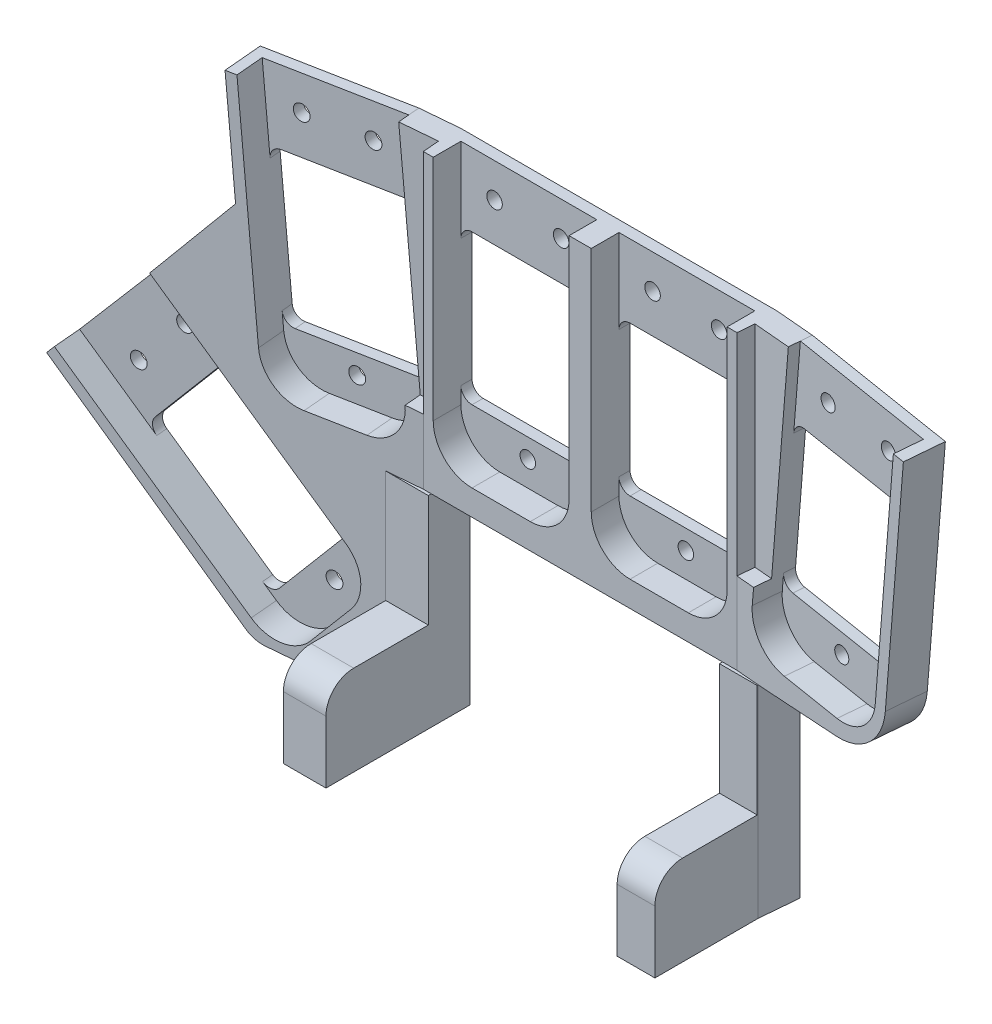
SolidWorks part; units mm, degrees
ref_plane "前视基准面" through (0, 0, 0) normal (0, 0, 1) x (1, 0, 0)
ref_plane "上视基准面" through (0, 0, 0) normal (0, 1, 0) x (1, 0, 0)
ref_plane "右视基准面" through (0, 0, 0) normal (1, 0, 0) x (0, 0, -1)
other "Configuration Table"
sketch "草图1" plane through (0, 0, 0) normal (0, 0, 1) x (1, 0, 0)
  line L0 (-6.3171, -14.436) -> (-6.3171, -11.436)
  line L1 (-8.3171, -13.436) -> (-28.8171, -13.436)
  line L2 (-30.8171, -11.436) -> (-30.8171, -14.436)
  line L3 (-23.8171, -21.436) -> (-13.3171, -21.436)
  line L4 (22.1829, -14.436) -> (22.1829, -11.436)
  line L5 (20.1829, -13.436) -> (-0.3171, -13.436)
  line L6 (-2.3171, -11.436) -> (-2.3171, -14.436)
  line L7 (4.6829, -21.436) -> (15.1829, -21.436)
  line L8 (22.1829, 11.564) -> (22.1829, 26.7199)
  line L9 (22.1829, 26.7199) -> (-2.3171, 26.7199)
  line L10 (-2.3171, 26.7199) -> (-2.3171, 11.564)
  line L11 (-0.3171, 13.564) -> (20.1829, 13.564)
  line L12 (-6.3171, 11.564) -> (-6.3171, 26.7199)
  line L13 (-6.3171, 26.7199) -> (-30.8171, 26.7199)
  line L14 (-30.8171, 26.7199) -> (-30.8171, 11.564)
  line L15 (-28.8171, 13.564) -> (-8.3171, 13.564)
  line L16 (-30.8171, 11.564) -> (-30.8171, -11.436)
  line L17 (-6.3171, 11.564) -> (-6.3171, -11.436)
  line L18 (22.1829, 11.564) -> (22.1829, -11.436)
  line L19 (-2.3171, 11.564) -> (-2.3171, -11.436)
  line L20 (-6.3171, 26.7199) -> (-2.3171, 26.7199)
  line L21 (-30.8171, 26.7199) -> (-32.8171, 26.7199)
  line L22 (-32.8171, 26.7199) -> (-32.8171, -25.4093)
  line L23 (-32.8171, -25.4093) -> (24.1829, -25.4093)
  line L24 (22.1829, 26.7199) -> (24.1829, 26.7199)
  line L25 (24.1829, 26.7199) -> (24.1829, -25.4093)
  arc A0 (-13.3171, -21.436) -> (-6.3171, -14.436) centre (-13.3171, -14.436) ccw
  arc A1 (-8.3171, -13.436) -> (-6.3171, -11.436) centre (-8.3171, -11.436) ccw
  arc A2 (-30.8171, -11.436) -> (-28.8171, -13.436) centre (-28.8171, -11.436) ccw
  arc A3 (-30.8171, -14.436) -> (-23.8171, -21.436) centre (-23.8171, -14.436) ccw
  arc A4 (15.1829, -21.436) -> (22.1829, -14.436) centre (15.1829, -14.436) ccw
  arc A5 (20.1829, -13.436) -> (22.1829, -11.436) centre (20.1829, -11.436) ccw
  arc A6 (-2.3171, -11.436) -> (-0.3171, -13.436) centre (-0.3171, -11.436) ccw
  arc A7 (-2.3171, -14.436) -> (4.6829, -21.436) centre (4.6829, -14.436) ccw
  arc A8 (-0.3171, 13.564) -> (-2.3171, 11.564) centre (-0.3171, 11.564) ccw
  arc A9 (22.1829, 11.564) -> (20.1829, 13.564) centre (20.1829, 11.564) ccw
  arc A10 (-28.8171, 13.564) -> (-30.8171, 11.564) centre (-28.8171, 11.564) ccw
  arc A11 (-6.3171, 11.564) -> (-8.3171, 13.564) centre (-8.3171, 11.564) ccw
sketch "草图2" plane through (0, 0, 0) normal (0, 0, 1) x (1, 0, 0)
  line L0 (-6.3171, -14.436) -> (-6.3171, -11.436)
  line L1 (-8.3171, -13.436) -> (-28.8171, -13.436)
  line L2 (-30.8171, -11.436) -> (-30.8171, -14.436)
  line L3 (-23.8171, -21.436) -> (-13.3171, -21.436)
  line L4 (22.1829, -14.436) -> (22.1829, -11.436)
  line L5 (20.1829, -13.436) -> (-0.3171, -13.436)
  line L6 (-2.3171, -11.436) -> (-2.3171, -14.436)
  line L7 (4.6829, -21.436) -> (15.1829, -21.436)
  line L8 (22.1829, 11.564) -> (22.1829, 26.7199)
  line L9 (22.1829, 26.7199) -> (-2.3171, 26.7199)
  line L10 (-2.3171, 26.7199) -> (-2.3171, 11.564)
  line L11 (-0.3171, 13.564) -> (20.1829, 13.564)
  line L12 (-6.3171, 11.564) -> (-6.3171, 26.7199)
  line L13 (-6.3171, 26.7199) -> (-30.8171, 26.7199)
  line L14 (-30.8171, 26.7199) -> (-30.8171, 11.564)
  line L15 (-28.8171, 13.564) -> (-8.3171, 13.564)
  line L16 (-30.8171, 11.564) -> (-30.8171, -11.436)
  line L17 (-6.3171, 11.564) -> (-6.3171, -11.436)
  line L18 (22.1829, 11.564) -> (22.1829, -11.436)
  line L19 (-2.3171, 11.564) -> (-2.3171, -11.436)
  line L20 (-6.3171, 26.7199) -> (-2.3171, 26.7199)
  line L21 (-30.8171, 26.7199) -> (-32.8171, 26.7199)
  line L22 (-32.8171, 26.7199) -> (-32.8171, -25.4093)
  line L23 (-32.8171, -25.4093) -> (24.1829, -25.4093)
  line L24 (22.1829, 26.7199) -> (24.1829, 26.7199)
  line L25 (24.1829, 26.7199) -> (24.1829, -25.4093)
  arc A0 (-13.3171, -21.436) -> (-6.3171, -14.436) centre (-13.3171, -14.436) ccw
  arc A1 (-8.3171, -13.436) -> (-6.3171, -11.436) centre (-8.3171, -11.436) ccw
  arc A2 (-30.8171, -11.436) -> (-28.8171, -13.436) centre (-28.8171, -11.436) ccw
  arc A3 (-30.8171, -14.436) -> (-23.8171, -21.436) centre (-23.8171, -14.436) ccw
  arc A4 (15.1829, -21.436) -> (22.1829, -14.436) centre (15.1829, -14.436) ccw
  arc A5 (20.1829, -13.436) -> (22.1829, -11.436) centre (20.1829, -11.436) ccw
  arc A6 (-2.3171, -11.436) -> (-0.3171, -13.436) centre (-0.3171, -11.436) ccw
  arc A7 (-2.3171, -14.436) -> (4.6829, -21.436) centre (4.6829, -14.436) ccw
  arc A8 (-0.3171, 13.564) -> (-2.3171, 11.564) centre (-0.3171, 11.564) ccw
  arc A9 (22.1829, 11.564) -> (20.1829, 13.564) centre (20.1829, 11.564) ccw
  arc A10 (-28.8171, 13.564) -> (-30.8171, 11.564) centre (-28.8171, 11.564) ccw
  arc A11 (-6.3171, 11.564) -> (-8.3171, 13.564) centre (-8.3171, 11.564) ccw
extrude "凸台-拉伸3" add sketch "草图1" along normal blind 2 contours A11 L12 L13 L14 A10 L15 | A9 L8 L9 L10 A8 L11 | L6 A7 L7 A4 L4 A5 L5 A6 | L2 A3 L3 A0 L0 A1 L1 A2 | A7 L6 L19 L10 L20 L12 L17 L0 A0 L3 A3 L2 L16 L14 L21 L22 L23 L25 L24 L8 L18 L4 A4 L7
sketch "草图4" plane through (0, 0, 2) normal (0, 0, 1) x (1, 0, 0)
  line L0 (4.6829, -21.436) -> (15.1829, -21.436) construction
  line L1 (22.1829, -14.436) -> (22.1829, -11.436) construction
  line L2 (22.1829, 11.564) -> (22.1829, -11.436) construction
  line L3 (22.1829, 26.7199) -> (24.1829, 26.7199) construction
  line L4 (24.1829, 26.7199) -> (24.1829, -25.4093) construction
  line L5 (22.1829, 11.564) -> (22.1829, 26.7199) construction
  line L6 (-2.3171, 26.7199) -> (-2.3171, 11.564) construction
  line L7 (-2.3171, 11.564) -> (-2.3171, -11.436) construction
  line L8 (-2.3171, -11.436) -> (-2.3171, -14.436) construction
  line L9 (-32.8171, -25.4093) -> (24.1829, -25.4093) construction
  line L10 (-32.8171, 26.7199) -> (-32.8171, -25.4093) construction
  line L11 (-30.8171, 26.7199) -> (-32.8171, 26.7199) construction
  line L12 (-6.3171, 11.564) -> (-6.3171, 26.7199) construction
  line L13 (-6.3171, 11.564) -> (-6.3171, -11.436) construction
  line L14 (-6.3171, -14.436) -> (-6.3171, -11.436) construction
  line L15 (-23.8171, -21.436) -> (-13.3171, -21.436) construction
  line L16 (-30.8171, -11.436) -> (-30.8171, -14.436) construction
  line L17 (-30.8171, 11.564) -> (-30.8171, -11.436) construction
  line L18 (-30.8171, 26.7199) -> (-30.8171, 11.564) construction
  line L19 (4.6829, -21.436) -> (15.1829, -21.436)
  line L20 (22.1829, -14.436) -> (22.1829, -11.436)
  line L21 (22.1829, 11.564) -> (22.1829, -11.436)
  line L22 (22.1829, 26.7199) -> (24.1829, 26.7199)
  line L23 (24.1829, 26.7199) -> (24.1829, -25.4093)
  line L24 (22.1829, 11.564) -> (22.1829, 26.7199)
  line L25 (-2.3171, 26.7199) -> (-2.3171, 11.564)
  line L26 (-2.3171, 11.564) -> (-2.3171, -11.436)
  line L27 (-2.3171, -11.436) -> (-2.3171, -14.436)
  line L28 (-32.8171, -25.4093) -> (24.1829, -25.4093)
  line L29 (-32.8171, 26.7199) -> (-32.8171, -25.4093)
  line L30 (-30.8171, 26.7199) -> (-32.8171, 26.7199)
  line L31 (-6.3171, 11.564) -> (-6.3171, 26.7199)
  line L32 (-6.3171, 11.564) -> (-6.3171, -11.436)
  line L33 (-6.3171, -14.436) -> (-6.3171, -11.436)
  line L34 (-23.8171, -21.436) -> (-13.3171, -21.436)
  line L35 (-30.8171, -11.436) -> (-30.8171, -14.436)
  line L36 (-30.8171, 11.564) -> (-30.8171, -11.436)
  line L37 (-30.8171, 26.7199) -> (-30.8171, 11.564)
  line L38 (-6.3171, 26.7199) -> (-2.3171, 26.7199)
  arc A0 (15.1829, -21.436) -> (22.1829, -14.436) centre (15.1829, -14.436) ccw construction
  arc A1 (-2.3171, -14.436) -> (4.6829, -21.436) centre (4.6829, -14.436) ccw construction
  arc A2 (-13.3171, -21.436) -> (-6.3171, -14.436) centre (-13.3171, -14.436) ccw construction
  arc A3 (-30.8171, -14.436) -> (-23.8171, -21.436) centre (-23.8171, -14.436) ccw construction
  arc A4 (15.1829, -21.436) -> (22.1829, -14.436) centre (15.1829, -14.436) ccw
  arc A5 (-2.3171, -14.436) -> (4.6829, -21.436) centre (4.6829, -14.436) ccw
  arc A6 (-13.3171, -21.436) -> (-6.3171, -14.436) centre (-13.3171, -14.436) ccw
  arc A7 (-30.8171, -14.436) -> (-23.8171, -21.436) centre (-23.8171, -14.436) ccw
extrude "凸台-拉伸4" add sketch "草图4" along normal blind 5
sketch "草图5" plane through (0, 0, 2) normal (0, 0, 1) x (1, 0, 0)
  circle A0 centre (9.747, -16.936) radius 1.4
  circle A5 centre (-18.753, -16.936) radius 1.4
  circle A10 centre (-24.753, 20.564) radius 1.4
  circle A11 centre (-12.753, 20.564) radius 1.4
  circle A13 centre (3.747, 20.564) radius 1.4
  circle A14 centre (15.747, 20.564) radius 1.4
extrude "切除-拉伸1" cut sketch "草图5" against normal blind 5
sketch "草图7" plane through (0, 26.7199, 0) normal (0, 1, 0) x (1, 0, 0)
  line L0 (-32.8171, 0) -> (-70.2267, -3.2729)
  line L1 (-32.8171, -7) -> (-32.8171, 0) construction
  line L2 (-32.8171, 0) -> (-32.8171, -2)
  line L3 (-32.8171, -2) -> (-70.053, -5.2577)
  line L4 (-70.2267, -3.2729) -> (-70.053, -5.2577)
  dimension "D1" = 85
extrude "凸台-拉伸5" add sketch "草图7" against normal up to surface (52.1292 mm away)
sketch "草图8" plane through (-0.0756, 0, -0.8645) normal (0.0872, 0, 0.9962) x (0.9962, 0, -0.0872)
  line L0 (-36.1156, -14.2794) -> (-36.3771, -11.2908)
  line L2 (-60.7838, -13.4261) -> (-60.5224, -16.4147)
  line L4 (-38.3817, 11.6217) -> (-39.7026, 26.7199)
  line L5 (-39.7026, 26.7199) -> (-64.1093, 24.5846)
  line L6 (-64.1093, 24.5846) -> (-62.7884, 9.4864)
  line L8 (-62.7884, 9.4864) -> (-60.7838, -13.4261)
  line L9 (-38.3817, 11.6217) -> (-36.3771, -11.2908)
  line L10 (-70.2447, 26.7199) -> (-32.8666, 26.7199) construction
  line L11 (-36.1156, -14.2794) -> (-36.3771, -11.2908)
  line L12 (-38.1951, -13.4575) -> (-58.6171, -15.2442)
  line L13 (-52.9389, -22.7779) -> (-42.4789, -21.8628)
  line L14 (-60.9703, 11.6531) -> (-40.5484, 13.4398)
  line L15 (-38.3817, 11.6217) -> (-39.7026, 26.7199)
  arc A1 (-38.1951, -13.4575) -> (-36.3771, -11.2908) centre (-38.3695, -11.4651) ccw
  arc A2 (-60.7838, -13.4261) -> (-58.6171, -15.2442) centre (-58.7915, -13.2518) ccw
  arc A3 (-60.5224, -16.4147) -> (-52.9389, -22.7779) centre (-53.549, -15.8046) ccw
  arc A4 (-60.9703, 11.6531) -> (-62.7884, 9.4864) centre (-60.796, 9.6607) ccw
  arc A5 (-38.3817, 11.6217) -> (-40.5484, 13.4398) centre (-40.374, 11.4474) ccw
  circle A6 centre (-48.2863, -17.8537) radius 1.4
  arc A7 (-38.1951, -13.4575) -> (-36.3771, -11.2908) centre (-38.3695, -11.4651) ccw
  arc A8 (-42.4789, -21.8628) -> (-36.1156, -14.2794) centre (-43.089, -14.8894) ccw
  circle A9 centre (-57.5318, 18.9807) radius 1.4
  circle A10 centre (-45.5775, 20.0265) radius 1.4
  arc A11 (-38.3817, 11.6217) -> (-40.5484, 13.4398) centre (-40.374, 11.4474) ccw
extrude "切除-拉伸2" cut sketch "草图8" against normal blind 54 contours A9 | A10 | A6 | L9 A5 L14 A4 L8 A2 L12 A1
sketch "草图9" plane through (-0.0756, 0, -0.8645) normal (0.0872, 0, 0.9962) x (0.9962, 0, -0.0872)
  line L0 (-38.3817, 11.6217) -> (-39.7026, 26.7199)
  line L1 (-70.2447, 26.7199) -> (-32.8666, 26.7199) construction
  line L2 (-39.7026, 26.7199) -> (-32.8666, 26.7199)
  line L3 (-32.8666, 26.7199) -> (-32.8666, -25.4093)
  line L4 (-32.8666, -25.4093) -> (-61.7354, -25.4093)
  line L5 (-60.7838, -13.4261) -> (-60.5224, -16.4147)
  line L6 (-60.7838, -13.4261) -> (-62.7884, 9.4864)
  line L7 (-62.7884, 9.4864) -> (-64.2962, 26.7199)
  line L8 (-64.2962, 26.7199) -> (-66.2962, 26.7199)
  line L9 (-66.2962, 26.7199) -> (-61.7354, -25.4093)
  line L10 (-60.7838, -13.4261) -> (-60.5224, -16.4147)
  line L11 (-36.1156, -14.2794) -> (-36.3771, -11.2908)
  line L13 (-52.9389, -22.7779) -> (-42.4789, -21.8628)
  line L14 (-38.3817, 11.6217) -> (-36.3771, -11.2908)
  circle A0 centre (-48.2863, -17.8537) radius 1.4
  arc A2 (-60.5224, -16.4147) -> (-52.9389, -22.7779) centre (-53.549, -15.8046) ccw
  arc A4 (-42.4789, -21.8628) -> (-36.1156, -14.2794) centre (-43.089, -14.8894) ccw
extrude "凸台-拉伸6" add sketch "草图9" along normal blind 5 contours A4 L13 A2 L5 L7 L9 L0 L11 M26 M19 M17 M18 M22
sketch "草图10" plane through (0, 26.7199, 0) normal (0, 1, 0) x (1, 0, 0)
  line L0 (24.1829, 0) -> (76.1307, -4.5448)
  line L1 (24.1829, -7) -> (24.1829, 0) construction
  line L3 (24.1829, -2) -> (76.1722, -6.5485)
  line L4 (76.1307, -4.5448) -> (76.1722, -6.5485)
  line L5 (24.1829, 0) -> (24.1829, -2)
  dimension "D1" = 85
extrude "凸台-拉伸7" add sketch "草图10" against normal up to surface (52.1292 mm away)
sketch "草图11" plane through (0.01, 0, -0.1148) normal (-0.0872, 0, 0.9962) x (0.9962, 0, 0.0872)
  line L0 (29.7802, 11.6217) -> (27.7757, -11.2908)
  line L1 (44.3375, -22.7779) -> (33.8775, -21.8628)
  line L2 (27.5142, -14.2794) -> (27.7757, -11.2908)
  line L3 (52.1824, -13.4261) -> (51.921, -16.4147)
  line L4 (57.6948, 26.7199) -> (53.134, -25.4093)
  line L5 (55.6948, 26.7199) -> (57.6948, 26.7199)
  line L6 (54.187, 9.4864) -> (55.6948, 26.7199)
  line L7 (52.1824, -13.4261) -> (54.187, 9.4864)
  line L8 (52.1824, -13.4261) -> (51.921, -16.4147)
  line L9 (24.2652, -25.4093) -> (53.134, -25.4093)
  line L10 (24.2652, 26.7199) -> (24.2652, -25.4093)
  line L11 (31.1012, 26.7199) -> (24.2652, 26.7199)
  line L12 (29.7802, 11.6217) -> (31.1012, 26.7199)
  arc A0 (33.8775, -21.8628) -> (27.5142, -14.2794) centre (34.4876, -14.8894) cw
  arc A1 (51.921, -16.4147) -> (44.3375, -22.7779) centre (44.9476, -15.8046) cw
  circle A2 centre (39.6849, -17.8537) radius 1.4
extrude "凸台-拉伸8" add sketch "草图11" along normal blind 5 contours L3 A1 L1 A0 L2 L0 L12 L4 L6 L7 M3 M4 M1
sketch "草图12" plane through (0.01, 0, -0.1148) normal (-0.0872, 0, 0.9962) x (0.9962, 0, 0.0872)
  line L6 (50.0157, -15.2442) -> (29.5937, -13.4575)
  line L8 (31.9469, 13.4398) -> (52.3689, 11.6531)
  line L9 (29.7802, 11.6217) -> (27.7757, -11.2908)
  line L10 (54.187, 9.4864) -> (52.1824, -13.4261)
  circle A5 centre (36.6057, 20.0589) radius 1.4
  circle A6 centre (48.56, 19.0131) radius 1.4
  circle A7 centre (39.3145, -17.8213) radius 1.4
  arc A8 (27.7757, -11.2908) -> (29.5937, -13.4575) centre (29.768, -11.4651) ccw
  arc A10 (50.0157, -15.2442) -> (52.1824, -13.4261) centre (50.19, -13.2518) ccw
  arc A12 (54.187, 9.4864) -> (52.3689, 11.6531) centre (52.1946, 9.6607) ccw
  arc A13 (31.9469, 13.4398) -> (29.7802, 11.6217) centre (31.7726, 11.4474) ccw
extrude "切除-拉伸3" cut sketch "草图12" against normal blind 5
sketch "草图14" plane through (0, -25.4093, 0) normal (0, -1, 0) x (1, 0, 0)
  line L12 (52.5061, 9.4971) -> (23.9646, 7)
  line L13 (23.9646, 7) -> (-32.5988, 7)
  line L14 (-32.5988, 7) -> (-61.1404, 9.4971)
  line L15 (-61.1404, 9.4971) -> (-61.5762, 4.5161)
  line L16 (-61.5762, 4.5161) -> (-70.053, 5.2577)
  line L17 (-70.053, 5.2577) -> (-70.2267, 3.2729)
  line L18 (-70.2267, 3.2729) -> (-32.8171, 0)
  line L19 (-32.8171, 0) -> (24.1829, 0)
  line L20 (24.1829, 0) -> (76.1307, 4.5448)
  line L21 (76.1307, 4.5448) -> (76.1722, 6.5485)
  line L22 (76.1722, 6.5485) -> (52.9419, 4.5161)
  line L23 (52.9419, 4.5161) -> (52.5061, 9.4971)
  line L24 (52.5061, 9.4971) -> (23.9646, 7)
  line L26 (-32.5988, 7) -> (-61.1404, 9.4971)
  line L27 (-61.1404, 9.4971) -> (-61.5762, 4.5161)
  line L28 (-61.5762, 4.5161) -> (-70.053, 5.2577)
  line L29 (-70.053, 5.2577) -> (-70.2267, 3.2729)
  line L30 (-70.2267, 3.2729) -> (-32.8171, 0)
  line L31 (-32.8171, 0) -> (24.1829, 0)
  line L32 (24.1829, 0) -> (76.1307, 4.5448)
  line L33 (76.1307, 4.5448) -> (76.1722, 6.5485)
  line L34 (76.1722, 6.5485) -> (52.9419, 4.5161)
  line L35 (52.9419, 4.5161) -> (52.5061, 9.4971)
  line L36 (23.9646, 7) -> (-32.5988, 7)
  dimension "D1" = 0
extrude "凸台-拉伸9" add sketch "草图14" along normal blind 48
sketch "草图16" plane through (-69.9774, 0, 6.1222) normal (-0.9962, 0, 0.0872) x (0.0872, 0, 0.9962)
  line L4 (-2.8602, 26.7199) -> (-2.8602, -73.4093)
  line L5 (-2.8602, -73.4093) -> (-0.8678, -73.4093)
  line L6 (-0.8678, -73.4093) -> (-0.8678, 26.7199)
  line L7 (-0.8678, 26.7199) -> (-2.8602, 26.7199)
  line L8 (-2.8602, 26.7199) -> (-2.8602, -73.4093)
  line L9 (-2.8602, -73.4093) -> (-0.8678, -73.4093)
  line L10 (-0.8678, -73.4093) -> (-0.8678, 26.7199)
  line L11 (-0.8678, 26.7199) -> (-2.8602, 26.7199)
  dimension "D1" = 0
extrude "凸台-拉伸10" add sketch "草图16" along normal blind 31
sketch "草图19" plane through (-0.0756, 0, -0.8645) normal (0.0872, 0, 0.9962) x (0.9962, 0, -0.0872)
  line L5 (-66.2962, 26.7199) -> (-101.2447, 26.7199)
  line L6 (-101.2447, 26.7199) -> (-101.2447, -73.4093)
  line L7 (-101.2447, -73.4093) -> (-61.7354, -73.4093)
  line L8 (-61.7354, -73.4093) -> (-61.7354, -25.4093)
  line L9 (-61.7354, -25.4093) -> (-66.2962, 26.7199)
  line L10 (-66.2962, 26.7199) -> (-101.2447, 26.7199)
  line L11 (-101.2447, 26.7199) -> (-101.2447, -73.4093)
  line L12 (-101.2447, -73.4093) -> (-61.7354, -73.4093)
  line L13 (-61.7354, -73.4093) -> (-61.7354, -25.4093)
  line L14 (-61.7354, -25.4093) -> (-66.2962, 26.7199)
  dimension "D1" = 0
extrude "凸台-拉伸12" add sketch "草图19" along normal blind 5 contours L10 L11 L12 L13 L14
sketch "草图20" plane through (0.3601, 0, 4.1165) normal (0.0872, 0, 0.9962) x (0.9962, 0, -0.0872)
  line L0 (-45.9906, -40.369) -> (-48.2888, -38.4406)
  line L1 (-48.0423, -41.2583) -> (-61.2194, -56.9622)
  line L2 (-64.0371, -57.2087) -> (-61.7389, -59.1371)
  line L3 (-51.8771, -58.2743) -> (-45.1278, -50.2308)
  line L4 (-78.6472, -12.9668) -> (-94.4978, -31.6491)
  line L5 (-94.4978, -31.6491) -> (-81.6561, -42.4246)
  line L6 (-81.9026, -39.6069) -> (-68.7255, -23.903)
  line L7 (-65.9078, -23.6565) -> (-78.6472, -12.9668)
  line L8 (-81.6561, -42.4246) -> (-64.0371, -57.2087)
  line L9 (-65.9078, -23.6565) -> (-48.2888, -38.4406)
  arc A0 (-45.1278, -50.2308) -> (-45.9906, -40.369) centre (-50.4902, -45.7313) ccw
  arc A1 (-48.0423, -41.2583) -> (-48.2888, -38.4406) centre (-49.5744, -39.9727) ccw
  arc A2 (-64.0371, -57.2087) -> (-61.2194, -56.9622) centre (-62.7515, -55.6766) ccw
  arc A3 (-61.7389, -59.1371) -> (-51.8771, -58.2743) centre (-57.2394, -53.7747) ccw
  arc A4 (-81.9026, -39.6069) -> (-81.6561, -42.4246) centre (-80.3705, -40.8925) ccw
  arc A5 (-65.9078, -23.6565) -> (-68.7255, -23.903) centre (-67.1934, -25.1886) ccw
  circle A6 centre (-76.9391, -22.8016) radius 1.4
  circle A7 centre (-84.6526, -31.9941) radius 1.4
  circle A8 centre (-52.0692, -51.5024) radius 1.4
extrude "切除-拉伸4" cut sketch "草图20" against normal blind 5 contours L9 A5 L6 A4 L8 A2 L1 A1 | A6 | A7 | A5 L7 L4 L5 A4 L6 A7 A6 | L2 A3 L3 A0 L0 A1 L1 A2 A8 | A8
sketch "草图22" plane through (-0.0756, 0, -0.8645) normal (0.0872, 0, 0.9962) x (0.9962, 0, -0.0872)
  circle A6 centre (-76.9391, -22.8016) radius 1.4
  circle A7 centre (-84.6526, -31.9941) radius 1.4
  circle A8 centre (-52.0692, -51.5024) radius 1.4
extrude "切除-拉伸5" cut sketch "草图22" against normal through all
sketch "草图23" plane through (-0.0756, 0, -0.8645) normal (0.0872, 0, 0.9962) x (0.9962, 0, -0.0872)
  line L1 (-48.0423, -41.2583) -> (-61.2194, -56.9622)
  line L6 (-81.9026, -39.6069) -> (-68.7255, -23.903)
  line L8 (-81.6561, -42.4246) -> (-64.0371, -57.2087)
  line L9 (-65.9078, -23.6565) -> (-48.2888, -38.4406)
  arc A1 (-48.0423, -41.2583) -> (-48.2888, -38.4406) centre (-49.5744, -39.9727) ccw
  arc A2 (-64.0371, -57.2087) -> (-61.2194, -56.9622) centre (-62.7515, -55.6766) ccw
  arc A4 (-81.9026, -39.6069) -> (-81.6561, -42.4246) centre (-80.3705, -40.8925) ccw
  arc A5 (-65.9078, -23.6565) -> (-68.7255, -23.903) centre (-67.1934, -25.1886) ccw
extrude "切除-拉伸6" cut sketch "草图23" against normal through all
sketch "草图24" plane through (0.3601, 0, 4.1165) normal (0.0872, 0, 0.9962) x (0.9962, 0, -0.0872)
  line L0 (-78.6472, -12.9668) -> (-94.4978, -31.6491)
  line L1 (-48.3684, -73.4093) -> (-101.2447, -73.4093)
  line L6 (-64.2962, 26.7199) -> (-101.2447, 26.7199) construction
  line L7 (-66.2962, 26.7199) -> (-64.3389, 4.3484)
  line L8 (-78.6472, -12.9668) -> (-64.3389, 4.3484)
  line L9 (-66.2962, 26.7199) -> (-101.2447, 26.7199)
  line L10 (-101.2447, 26.7199) -> (-101.2447, -73.4093)
  line L11 (-94.4978, -31.6491) -> (-95.7917, -33.1742)
  line L12 (-95.7917, -33.1742) -> (-48.3684, -73.4093)
  line L13 (-33.0849, -73.4093) -> (-101.2447, -73.4093) construction
extrude "切除-拉伸7" cut sketch "草图24" against normal through all
sketch "草图25" plane through (0, 0, 7) normal (0, 0, 1) x (1, 0, 0)
  line L8 (28.1628, -26.0179) -> (21.3541, -26.0179)
  line L9 (21.3541, -26.0179) -> (21.3541, -62.4789)
  line L10 (21.3541, -62.4789) -> (28.1628, -62.4789)
  line L11 (28.1628, -62.4789) -> (28.1628, -26.0179)
  line L12 (-38.8372, -62.4789) -> (-31.1575, -62.4789)
  line L13 (-31.1575, -62.4789) -> (-31.1575, -26.0179)
  line L14 (-31.1575, -26.0179) -> (-38.8372, -26.0179)
  line L15 (-38.8372, -26.0179) -> (-38.8372, -62.4789)
extrude "凸台-拉伸14" add sketch "草图25" along normal blind 19
sketch "草图26" plane through (0, 0, 7) normal (0, 0, 1) x (1, 0, 0)
  line L1 (-38.8372, -62.4789) -> (76.1722, -62.4789)
  line L2 (-38.8372, -62.4789) -> (-38.8372, -73.4093)
  line L3 (-38.8372, -73.4093) -> (76.1722, -73.4093)
  line L4 (76.1722, -62.4789) -> (76.1722, -73.4093)
  line L5 (-38.8372, -62.4789) -> (-63.6236, -62.4789)
  line L6 (-38.8372, -62.4789) -> (-38.8372, -73.4093)
  line L7 (-38.8372, -73.4093) -> (-63.6236, -73.4093)
  line L8 (-63.6236, -62.4789) -> (-63.6236, -73.4093)
extrude "切除-拉伸8" cut sketch "草图26" against normal through all and the other way through all contours L5 L8 L7 L2 | L1 M24 M25 M26 M27 M28 | L4 L1 L3 M27 | L2 L3 L1 M25
sketch "草图27" plane through (-0.4257, 0, 4.8661) normal (-0.0872, 0, 0.9962) x (0.9962, 0, 0.0872)
  line L1 (57.6948, 26.7199) -> (53.134, -25.4093) construction
  line L2 (57.6948, 26.7199) -> (53.134, -25.4093) construction
  line L3 (53.134, -25.4093) -> (28.6978, -26.0179)
  line L4 (28.6978, -26.0179) -> (28.6978, -62.4789)
  line L5 (28.6978, -62.4789) -> (53.134, -62.4789)
  line L7 (53.134, -62.4789) -> (53.134, -25.4093)
extrude "切除-拉伸9" cut sketch "草图27" against normal through all contours L3 L4 L5 L7
sketch "草图28" plane through (0.01, 0, -0.1148) normal (-0.0872, 0, 0.9962) x (0.9962, 0, 0.0872)
  line L5 (53.134, -62.4789) -> (76.4531, -62.4789)
  line L6 (76.4531, -62.4789) -> (76.4531, 26.7199)
  line L7 (76.4531, 26.7199) -> (57.6948, 26.7199)
  line L8 (57.6948, 26.7199) -> (53.134, -25.4093)
  line L11 (76.4531, -62.4789) -> (76.4531, 26.7199)
  line L12 (76.4531, 26.7199) -> (57.6948, 26.7199)
  line L13 (57.6948, 26.7199) -> (53.134, -25.4093)
  line L15 (53.134, -62.4789) -> (76.4531, -62.4789)
  line L17 (53.134, -25.4093) -> (53.134, -62.4789)
  line L18 (53.134, -25.4093) -> (53.134, -62.4789)
  dimension "D1" = 0
extrude "切除-拉伸10" cut sketch "草图28" against normal through all
sketch "草图29" plane through (-0.0756, 0, -0.8645) normal (0.0872, 0, 0.9962) x (0.9962, 0, -0.0872)
  line L0 (-39.7026, 26.7199) -> (-66.0942, 24.411)
  line L1 (-64.3389, 4.3484) -> (-66.2962, 26.7199) construction
  line L2 (-66.0942, 24.411) -> (-66.2962, 26.7199)
  line L3 (-66.2962, 26.7199) -> (-39.7026, 26.7199)
extrude "切除-拉伸11" cut sketch "草图29" against normal through all and the other way through all
sketch "草图31" plane through (0.01, 0, -0.1148) normal (-0.0872, 0, 0.9962) x (0.9962, 0, 0.0872)
  line L0 (31.1012, 26.7199) -> (57.4927, 24.411)
  line L1 (57.6948, 26.7199) -> (53.134, -25.4093) construction
  line L2 (57.4927, 24.411) -> (57.6948, 26.7199)
  line L3 (57.6948, 26.7199) -> (31.1012, 26.7199)
extrude "切除-拉伸13" cut sketch "草图31" against normal through all and the other way through all
sketch "草图32" plane through (0.3601, 0, 4.1165) normal (0.0872, 0, 0.9962) x (0.9962, 0, -0.0872)
  line L14 (-61.2515, -62.4789) -> (-39.347, -62.4789)
  line L15 (-39.347, -62.4789) -> (-39.347, -26.0179)
  line L16 (-64.1093, 24.5846) -> (-66.0942, 24.411)
  line L17 (-66.0942, 24.411) -> (-64.3389, 4.3484)
  line L18 (-64.3389, 4.3484) -> (-78.6472, -12.9668)
  line L19 (-78.6472, -12.9668) -> (-45.9906, -40.369)
  line L20 (-45.1278, -50.2308) -> (-51.8771, -58.2743)
  line L21 (-61.7389, -59.1371) -> (-94.4978, -31.6491)
  line L22 (-94.4978, -31.6491) -> (-95.7917, -33.1742)
  line L23 (-95.7917, -33.1742) -> (-61.2515, -62.4789)
  line L26 (-39.347, -62.4789) -> (-39.347, -26.0179)
  line L28 (-33.0849, 26.7199) -> (-39.7026, 26.7199)
  line L29 (-39.7026, 26.7199) -> (-36.1156, -14.2794)
  line L30 (-42.4789, -21.8628) -> (-52.9389, -22.7779)
  line L31 (-60.5224, -16.4147) -> (-64.1093, 24.5846)
  line L45 (-39.347, -26.0179) -> (-33.0849, -26.0179)
  line L46 (-33.0849, -26.0179) -> (-33.0849, 26.7199)
  arc A4 (-45.1278, -50.2308) -> (-45.9906, -40.369) centre (-50.4902, -45.7313) ccw
  arc A5 (-61.7389, -59.1371) -> (-51.8771, -58.2743) centre (-57.2394, -53.7747) ccw
  arc A6 (-42.4789, -21.8628) -> (-36.1156, -14.2794) centre (-43.089, -14.8894) ccw
  arc A7 (-60.5224, -16.4147) -> (-52.9389, -22.7779) centre (-53.549, -15.8046) ccw
  dimension "D1" = 0
sketch "草图33" plane through (0.3601, 0, 4.1165) normal (0.0872, 0, 0.9962) x (0.9962, 0, -0.0872)
  line L0 (-39.7026, 26.7199) -> (-33.0849, 26.7199)
  line L1 (-36.1156, -14.2794) -> (-33.0849, -14.2794)
  line L2 (-33.0849, 26.7199) -> (-33.0849, -14.2794)
  line L3 (-33.0849, -26.0179) -> (-33.0849, 26.7199) construction
  line L4 (-36.1156, -14.2794) -> (-39.7026, 26.7199)
extrude "切除-拉伸15" cut sketch "草图33" against normal blind 3
sketch "草图34" plane through (-0.4257, 0, 4.8661) normal (-0.0872, 0, 0.9962) x (0.9962, 0, 0.0872)
  line L0 (31.1012, 26.7199) -> (27.7757, -11.2908)
  line L1 (27.7757, -11.2908) -> (24.4835, -11.2908)
  line L2 (24.4835, 26.7199) -> (24.4835, -26.0179) construction
  line L3 (24.4835, -11.2908) -> (24.4835, 26.7199)
  line L4 (24.4835, 26.7199) -> (31.1012, 26.7199)
extrude "切除-拉伸16" cut sketch "草图34" against normal blind 3
sketch "草图35" plane through (0, 0, 7) normal (0, 0, 1) x (1, 0, 0)
  line L1 (-31.1575, -26.0179) -> (21.3541, -26.0179)
  line L2 (-31.1575, -26.0179) -> (-31.1575, -62.4789)
  line L3 (-31.1575, -62.4789) -> (21.3541, -62.4789)
  line L4 (21.3541, -26.0179) -> (21.3541, -62.4789)
extrude "切除-拉伸18" cut sketch "草图35" against normal blind 11
sketch "草图36" plane through (0, -62.4789, 0) normal (0, -1, 0) x (1, 0, 0)
  circle A0 centre (25.0484, 3) radius 1.4
  circle A1 centre (25.0484, 21) radius 1.4
  circle A2 centre (-35.9516, 3) radius 1.4
  circle A3 centre (-35.9516, 21) radius 1.4
extrude "切除-拉伸19" cut sketch "草图36" against normal blind 5
fillet "圆角1" radius 10 1 edges at (52.8108, -25.4093, 6.0142)
sketch "草图37" plane through (-38.8372, 0, 0) normal (-1, 0, 0) x (0, 0, 1)
  line L0 (7.5458, -62.4789) -> (7.5458, -26.0179) construction
  line L1 (26, -26.0179) -> (7.5458, -26.0179)
  line L2 (26, -26.0179) -> (26, -46.246)
  line L3 (26, -46.246) -> (7.5458, -46.246)
  line L4 (7.5458, -26.0179) -> (7.5458, -46.246)
extrude "切除-拉伸20" cut sketch "草图37" against normal blind 67
fillet "圆角2" radius 5 3 edges at (-60.963, -62.4789, 5.972) (24.7585, -46.246, 26) (-34.9973, -46.246, 26)
